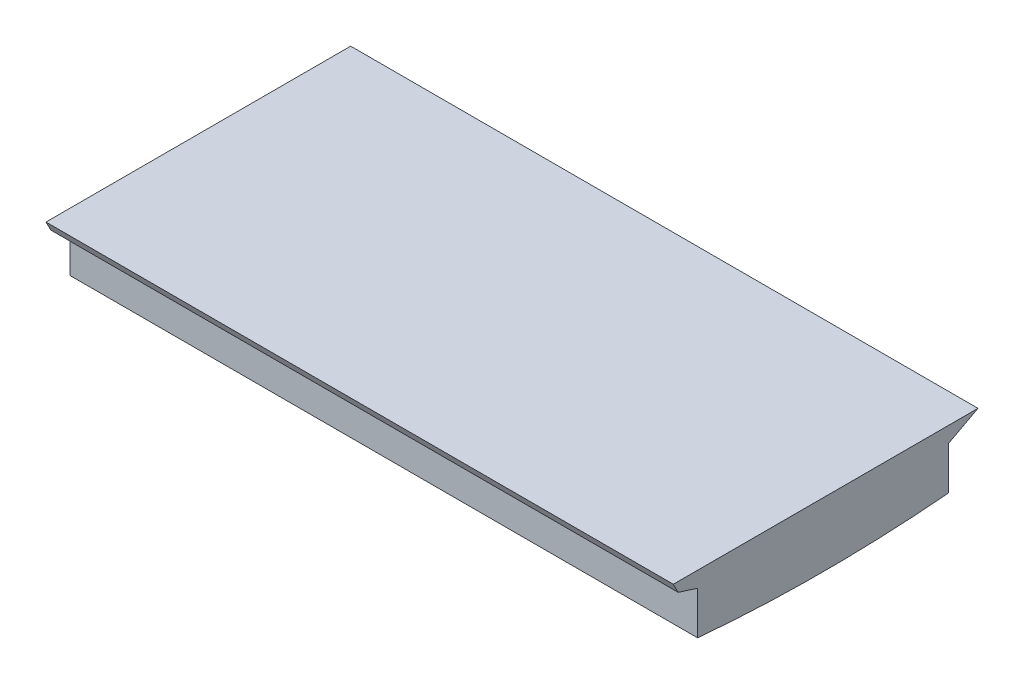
SolidWorks part; units mm, degrees
ref_plane "Front Plane" through (0, 0, 0) normal (0, 0, 1) x (1, 0, 0)
ref_plane "Top Plane" through (0, 0, 0) normal (0, 1, 0) x (1, 0, 0)
ref_plane "Right Plane" through (0, 0, 0) normal (1, 0, 0) x (0, 0, -1)
sketch "Sketch1" plane through (0, 0, 0) normal (1, 0, 0) x (0, 0, -1)
  line L0 (-6, 1.025) -> (6, -1.025) construction
  line L1 (-6, 1.025) -> (6, 1.025)
  line L2 (-6, 1.025) -> (-6, -1.025)
  line L3 (-6, -1.025) -> (6, -1.025)
  line L4 (6, 1.025) -> (6, -1.025)
  dimension "D1" = 12
  dimension "D2" = 2.05
extrude "Extrude1" add sketch "Sketch1" along normal mid plane 30
sketch "Sketch2" plane through (0, 0, 0) normal (1, 0, 0) x (0, 0, -1)
  line L2 (-8.3083, 1.775) -> (7.4105, 1.775)
  line L3 (-8.3083, 1.775) -> (-6, 1.025)
  line L4 (-6, 1.025) -> (6, 1.025)
  line L5 (6, 1.025) -> (7.4105, 1.775)
  dimension "D1" = 0.75
  dimension "D2" = 28
  dimension "D3" = 18
extrude "Extrude2" add sketch "Sketch2" along normal mid plane 30
sketch "Sketch3" plane through (15, 0, 0) normal (1, 0, 0) x (0, 0, -1)
  line L0 (-8.3083, 1.775) -> (-6.9292, 1.3269)
  line L4 (-8.3083, 1.775) -> (-6, 1.025) construction
  line L5 (7.4105, 1.775) -> (-8.3083, 1.775) construction
  line L6 (-7.1583, 1.775) -> (-8.3083, 1.775)
  line L7 (-6.9292, 1.3269) -> (-7.1583, 1.775)
  dimension "D1" = 1.15
  dimension "D2" = 1.45
extrude "Cut-Extrude1" cut sketch "Sketch3" against normal through all
sketch "Sketch4" plane through (15, 0, 0) normal (1, 0, 0) x (0, 0, -1)
  line L0 (-6, -1.025) -> (6, -1.025)
  arc A0 (-6, -1.025) -> (6, -1.025) centre (0, 66.2078) ccw
  dimension "D1" = 67.5
extrude "Extrude3" add sketch "Sketch4" against normal blind 30
